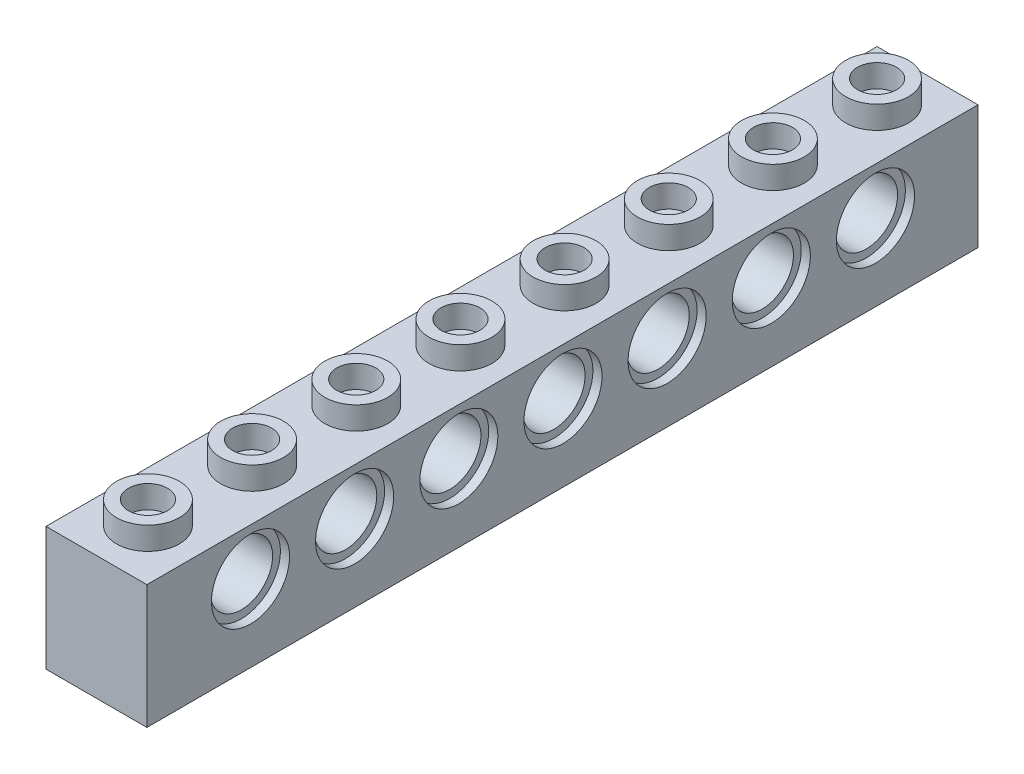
SolidWorks part; units mm, degrees
ref_plane "Front Plane" through (0, 0, 0) normal (0, 0, 1) x (1, 0, 0)
ref_plane "Top Plane" through (0, 0, 0) normal (0, 1, 0) x (1, 0, 0)
ref_plane "Right Plane" through (0, 0, 0) normal (1, 0, 0) x (0, 0, -1)
sketch "Sketch1" plane through (0, 0, 0) normal (0, 0, 1) x (1, 0, 0)
  line L1 (3.875, -4.75) -> (-3.875, -4.75)
  line L2 (3.875, -4.75) -> (3.875, 4.75)
  line L3 (3.875, 4.75) -> (-3.875, 4.75)
  line L4 (-3.875, -4.75) -> (-3.875, 4.75)
  line L5 (3.875, -4.75) -> (-3.875, 4.75) construction
  line L6 (3.875, 4.75) -> (-3.875, -4.75) construction
  point P0 (0, 0)
  dimension "D1" = 7.75
  dimension "D2" = 9.5
extrude "Boss-Extrude1" add sketch "Sketch1" along normal blind 63.83
sketch "Sketch2" plane through (0, 4.75, 0) normal (0, 1, 0) x (1, 0, 0)
  line L0 (0, 0) -> (0, -63.83) construction
  line L1 (3.875, -63.83) -> (-3.875, -63.83) construction
  line L2 (3.875, 0) -> (-3.875, 0) construction
  circle A0 centre (0, -3.875) radius 2.415
  circle A1 centre (0, -3.875) radius 1.5
  dimension "D1" = 4.83
  dimension "D2" = 3
  dimension "D3" = 3.875
extrude "Boss-Extrude2" add sketch "Sketch2" along normal blind 1.75
sketch "Sketch3" plane through (0, 4.75, 0) normal (0, 1, 0) x (1, 0, 0)
  line L0 (0, 0) -> (0, -63.83) construction
  line L1 (3.875, -63.83) -> (-3.875, -63.83) construction
pattern_linear "LPattern1" count 8 spacing 8 along (0, 0, 1) of "Boss-Extrude2"
sketch "Sketch4" plane through (0, -4.75, 0) normal (0, -1, 0) x (1, 0, 0)
  line L18 (-2.425, 62.38) -> (-2.425, 1.45)
  line L19 (2.425, 1.45) -> (2.425, 62.38)
  line L20 (-2.425, 1.45) -> (2.425, 1.45)
  line L21 (2.425, 62.38) -> (-2.425, 62.38)
  line L22 (-2.425, 62.38) -> (-2.425, 1.45)
  line L23 (2.425, 1.45) -> (2.425, 62.38)
  line L24 (-2.425, 1.45) -> (2.425, 1.45)
  line L25 (2.425, 62.38) -> (-2.425, 62.38)
  dimension "D1" = 1.45
extrude "Cut-Extrude1" cut sketch "Sketch4" against normal blind 1.75
sketch "Sketch5" plane through (0, -3, 0) normal (0, -1, 0) x (1, 0, 0)
  line L0 (0, 62.38) -> (0, 1.45) construction
  line L1 (2.425, 62.38) -> (-2.425, 62.38) construction
  line L2 (-2.425, 1.45) -> (2.425, 1.45) construction
  line L3 (-3.875, 63.83) -> (3.875, 63.83) construction
  circle A0 centre (0, 56.23) radius 1.5
  dimension "D1" = 3
  dimension "D2" = 7.6
extrude "Boss-Extrude3" add sketch "Sketch5" along normal blind 1.75
pattern_linear "LPattern2" count 7 spacing 8 along (0, 0, -1) of "Boss-Extrude3"
sketch "Sketch6" plane through (3.875, 0, 0) normal (1, 0, 0) x (0, 0, -1)
  line L0 (-63.83, 1.15) -> (0, 1.15) construction
  line L1 (-63.83, -4.75) -> (-63.83, 4.75) construction
  line L2 (0, -4.75) -> (0, 4.75) construction
  line L3 (-63.83, 4.75) -> (0, 4.75) construction
  line L4 (-7.875, 4.75) -> (-7.875, -6.7669) construction
  line L5 (-6.29, 6.5) -> (-6.29, 4.75) construction
  circle A0 centre (-7.875, 1.15) radius 3
  dimension "D3" = 6
  dimension "D1" = 3.6
  dimension "D2" = 1.585
extrude "Cut-Extrude2" cut sketch "Sketch6" against normal blind 0.7
sketch "Sketch7" plane through (-3.875, 0, 0) normal (-1, 0, 0) x (0, 0, 1)
  circle A0 centre (7.875, 1.15) radius 3
  dimension "D1" = 6
extrude "Cut-Extrude3" cut sketch "Sketch7" against normal blind 0.7
sketch "Sketch8" plane through (-3.875, 0, 0) normal (-1, 0, 0) x (0, 0, 1)
  circle A0 centre (7.875, 1.15) radius 2.4
  dimension "D1" = 4.8
extrude "Cut-Extrude4" cut sketch "Sketch8" against normal through all
pattern_linear "LPattern3" count 7 spacing 8 along (0, 0, 1) of "Cut-Extrude4", "Cut-Extrude3", "Cut-Extrude2"
